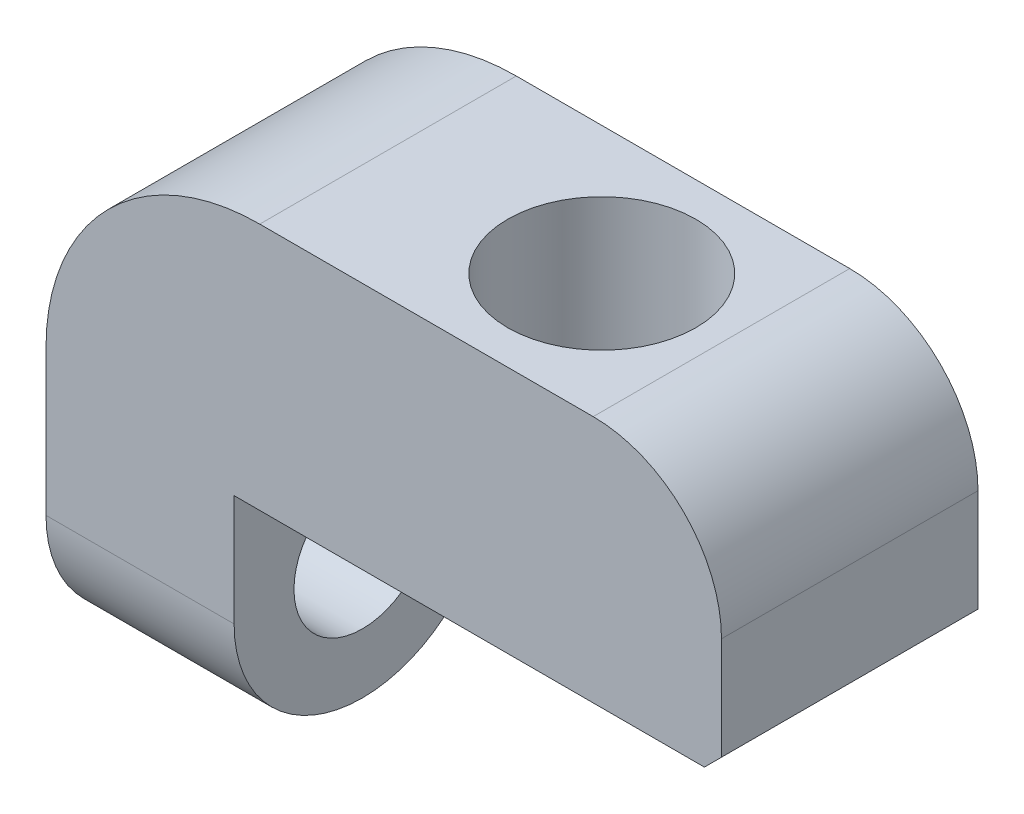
SolidWorks part; units mm, degrees
ref_plane "Plan de face" through (0, 0, 0) normal (0, 0, 1) x (1, 0, 0)
ref_plane "Plan de dessus" through (0, 0, 0) normal (0, 1, 0) x (1, 0, 0)
ref_plane "Plan de droite" through (0, 0, 0) normal (1, 0, 0) x (0, 0, -1)
sketch "Esquisse1" plane through (0, 0, 0) normal (0, 0, 1) x (1, 0, 0)
  line L1 (0, 0) -> (81, 0)
  line L2 (0, 0) -> (0, 59)
  line L3 (0, 59) -> (81, 59)
  line L4 (81, 0) -> (81, 59)
  dimension "D1" = 59
  dimension "D2" = 81
extrude "Extrusion1" add sketch "Esquisse1" along normal blind 39
sketch "Esquisse2" plane through (0, 0, 39) normal (0, 0, 1) x (1, 0, 0)
  line L0 (1, 33) -> (1, 1)
  line L1 (1, 1) -> (80, 1)
  line L4 (80, 1) -> (80, 43)
  line L5 (65, 58) -> (26, 58)
  line L6 (0, 59) -> (0, 0) construction
  line L7 (81, 59) -> (0, 59) construction
  arc A0 (80, 43) -> (65, 58) centre (65, 43) ccw
  arc A1 (26, 58) -> (1, 33) centre (26, 33) ccw
  point P12 (80, 58)
  dimension "D7" = 15
  dimension "D8" = 25
  dimension "D2" = 79
  dimension "D3" = 1
  dimension "D4" = 1
  dimension "D5" = 57
extrude "Enlèv. mat.-Extru.1" cut sketch "Esquisse2" against normal blind 31 flip side to cut
sketch "Esquisse5" plane through (1, 0, 0) normal (-1, 0, 0) x (0, 0, 1)
  line L0 (9, 60.7958) -> (9, -1.7086)
  line L1 (39, 33) -> (39, 58) construction
  dimension "D1" = 30
extrude "Enlèv. mat.-Extru.5" cut sketch "Esquisse5" against normal through all and the other way through all flip side to cut
sketch "Esquisse12" plane through (0, 0, 9) normal (0, 0, -1) x (-1, 0, 0)
  line L0 (-1, 1) -> (-1, 33) construction
  line L1 (-82.2408, -4.1539) -> (-23, -4.1539)
  line L2 (-82.2408, -4.1539) -> (-82.2408, 29)
  line L3 (-82.2408, 29) -> (-23, 29)
  line L4 (-23, -4.1539) -> (-23, 29)
  line L5 (-80, 1) -> (-1, 1) construction
  dimension "D1" = 22
  dimension "D2" = 28
extrude "Enlèv. mat.-Extru.10" cut sketch "Esquisse12" against normal through all
sketch "Esquisse6" plane through (0, 29, 0) normal (0, -1, 0) x (1, 0, 0)
  line L0 (65.5, 35) -> (36.5, 35)
  line L1 (65.5, 13) -> (36.5, 13)
  line L4 (23, 39) -> (23, 9) construction
  line L5 (23, 39) -> (80, 39) construction
  arc A0 (65.5, 35) -> (65.5, 13) centre (65.5, 24) cw
  arc A1 (36.5, 35) -> (36.5, 13) centre (36.5, 24) ccw
  dimension "D3" = 11
  dimension "D1" = 15
  dimension "D2" = 29
  dimension "D4" = 13.5
extrude "Enlèv. mat.-Extru.6" cut sketch "Esquisse6" against normal blind 2.5
sketch "Esquisse7" plane through (0, 31.5, 0) normal (0, -1, 0) x (1, 0, 0)
  line L2 (65.5, 35) -> (36.5, 35) construction
  line L3 (23, 39) -> (23, 9) construction
  circle A0 centre (51, 24) radius 11
  dimension "D1" = 22
  dimension "D2" = 28
extrude "Enlèv. mat.-Extru.7" cut sketch "Esquisse7" against normal through all
hole_wizard "Trou taraudé M4x0.71" positions "Esquisse9" profile "Esquisse8" tap size "M4x0.7" standard "Ansi Métrique"
sketch "Esquisse9" plane through (0, 31.5, 0) normal (0, -1, 0) x (1, 0, 0)
  line L2 (23, 39) -> (23, 9) construction
  line L3 (23, 39) -> (80, 39) construction
  point P0 (68, 24)
  point P3 (34, 24)
  dimension "D1" = 11
  dimension "D2" = 34
  dimension "D3" = 15
sketch "Esquisse8" plane through (68, 31.5, 24) normal (1, 0, 0) x (0, 0, -1)
  line L0 (0, 0) -> (0, 18.0914)
  line L1 (0, 18.0914) -> (1.65, 17.1)
  line L2 (1.65, 17.1) -> (1.65, 1.85)
  line L3 (1.65, 1.85) -> (3.5, 0)
  line L5 (3.5, 0) -> (0, 0)
  line L6 (-1.65, 1.85) -> (-3.5, 0) construction
  line L10 (0, 18.0914) -> (-1.65, 17.1) construction
  line L11 (0, -6.35) -> (0, 107.95) construction
  dimension "Diamètre du trou pour taraudage" = 3.3
  dimension "Profondeur du trou pour taraudage" = 17.1
  dimension "Diamètre du fraisage entrant" = 7
  dimension "Angle du fraisage entrant" = 90
  dimension "Angle de pointe" = 118
fillet "Congé2" radius 15 4 edges at (12, 1, 39) (1, 1, 24) (12, 1, 9) (23, 1, 24)
sketch "Esquisse10" plane through (1, 0, 0) normal (-1, 0, 0) x (0, 0, 1)
  circle A0 centre (24, 16) radius 8
  arc A1 (24, 1) -> (39, 16) centre (24, 16) ccw construction
  dimension "D1" = 16
extrude "Enlèv. mat.-Extru.8" cut sketch "Esquisse10" against normal through all
ref_plane "Plan1" through (0, 0, 24) normal (0, 0, -1) x (-1, 0, 0)
chamfer "Chanfrein1" distance 2 angle 45 1 edges at (80, 29, 24)
sketch "Esquisse13" plane through (0, 0, 39) normal (0, 0, 1) x (1, 0, 0)
  line L0 (65, 58) -> (26, 58) construction
  line L1 (80, 1) -> (80, 43) construction
  point P0 (80, 58)
sketch "Esquisse14" plane through (0, 0, 39) normal (0, 0, 1) x (1, 0, 0)
  line L0 (65, 58) -> (26, 58) construction
  line L1 (1, 33) -> (1, 1) construction
  point P0 (1, 58)
